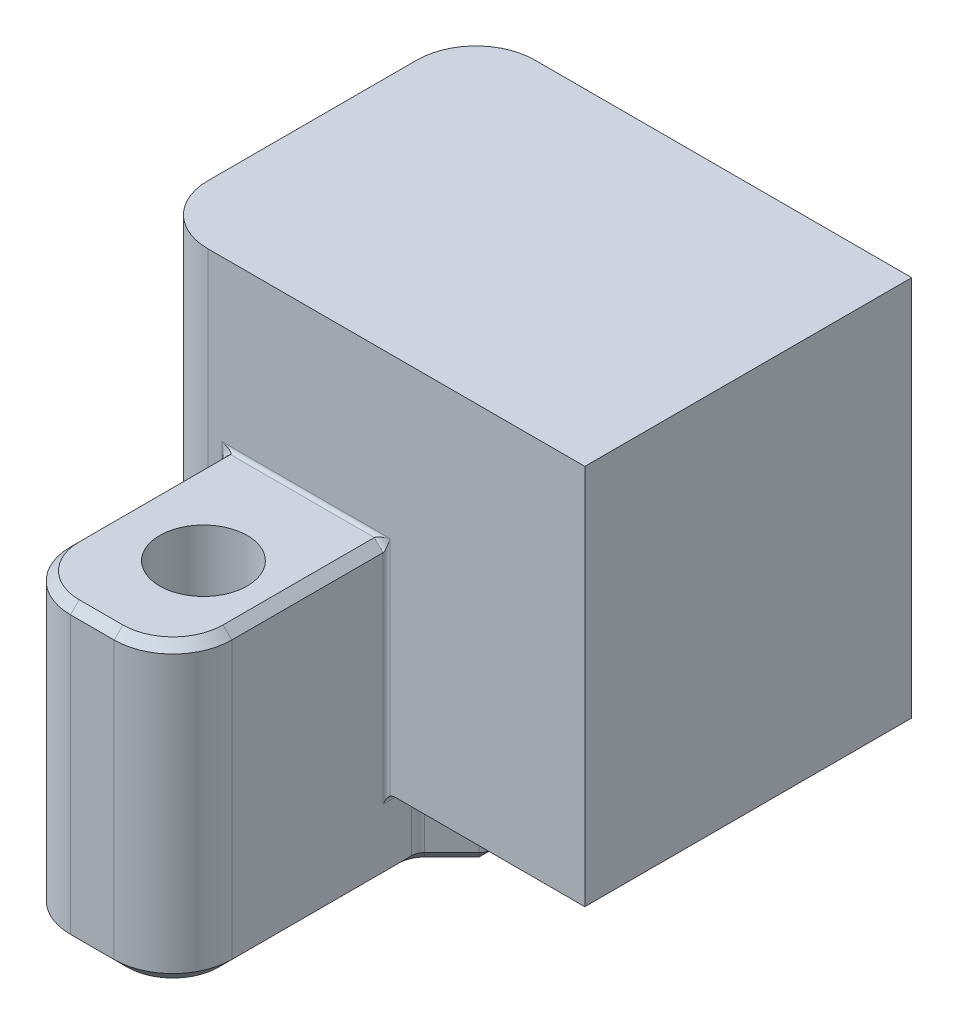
SolidWorks part; units mm, degrees
ref_plane "Front Plane" through (0, 0, 0) normal (0, 0, 1) x (1, 0, 0)
ref_plane "Top Plane" through (0, 0, 0) normal (0, 1, 0) x (1, 0, 0)
ref_plane "Right Plane" through (0, 0, 0) normal (1, 0, 0) x (0, 0, -1)
sketch "Sketch1" plane through (0, 0, 0) normal (0, 0, 1) x (1, 0, 0)
  line L0 (0, 0) -> (0, -22.225)
  line L5 (0, -22.225) -> (-9.525, -22.225)
  line L6 (-25.4, -26.924) -> (-25.4, 0)
  line L7 (-25.4, 0) -> (0, 0)
  line L10 (-25.4, -26.924) -> (-9.525, -26.924)
  line L13 (-9.525, -26.924) -> (-9.525, -22.225)
  dimension "D2" = 26.924
  dimension "D5" = 25.4
  dimension "D6" = 22.225
  dimension "D9" = 4.699
  dimension "D10" = 15.875
extrude "Boss-Extrude1" add sketch "Sketch1" along normal mid plane 19.05 contours L5 L13 L10 L6 L7 L0
fillet "Fillet5" radius 3.429 2 edges at (-25.4, -13.462, -9.525) (-25.4, -13.462, 9.525)
sketch "Sketch7" plane through (0, -26.924, 0) normal (0, -1, 0) x (1, 0, 0)
  line L0 (0, 9.525) -> (-9.525, 9.525) construction
  line L1 (-20.955, 9.525) -> (-11.557, 9.525)
  line L2 (-20.955, 9.525) -> (-20.955, 18.542)
  line L3 (-17.526, 21.971) -> (-14.986, 21.971)
  line L4 (-11.557, 9.525) -> (-11.557, 18.542)
  line L5 (0, 9.525) -> (0, -9.525) construction
  line L9 (-21.971, -9.525) -> (0, -9.525) construction
  line L10 (0, 9.525) -> (0, -9.525) construction
  line L11 (-21.971, 9.525) -> (0, 9.525) construction
  line L12 (-15.875, 15.875) -> (-17.9578, 15.875) construction
  line L13 (-17.5768, 13.589) -> (-15.5448, 13.589) construction
  line L15 (-17.5768, 18.161) -> (-15.5448, 18.161) construction
  line L17 (-22.225, 9.525) -> (-22.225, 40.8407) construction
  line L18 (-9.525, 9.525) -> (-9.525, 41.1038) construction
  arc A2 (-14.986, 21.971) -> (-11.557, 18.542) centre (-14.986, 18.542) cw
  arc A3 (-20.955, 18.542) -> (-17.526, 21.971) centre (-17.526, 18.542) cw
  circle A6 centre (-15.875, 15.875) radius 2.0828 construction
  arc A7 (-17.5768, 18.161) -> (-17.5768, 13.589) centre (-17.5768, 15.875) ccw construction
  arc A8 (-15.5448, 13.589) -> (-15.5448, 18.161) centre (-15.5448, 15.875) ccw construction
  dimension "D1" = 3.429
  dimension "D8" = 15.875
  dimension "D9" = 4.1656
  dimension "D10" = 9.398
  dimension "D6" = 6.604
  dimension "D11" = 1.0922
  dimension "D12" = 22.225
  dimension "D3" = 1.905
  dimension "D2" = 20.955
  dimension "D4" = 25.4
  dimension "D5" = 4.572
  dimension "D7" = 12.446
  dimension "D13" = 12.7
  dimension "D14" = 2.032
  dimension "D15" = 1.27
extrude "Boss-Extrude2" add sketch "Sketch7" against normal offset from surface (17.399 mm away) 9.525
fillet "Fillet6" radius 0.2032 3 edges at (-11.557, -18.2245, 9.525) (-20.955, -18.2245, 9.525) (-16.256, -9.525, 9.525)
sketch "Sketch13" plane through (0, -26.924, 0) normal (0, -1, 0) x (-1, 0, 0)
  line L4 (11.557, -7.747) -> (9.525, -5.715)
  line L9 (9.525, -9.525) -> (9.525, 9.525) construction
  line L16 (9.525, 5.715) -> (13.335, 9.525)
  line L19 (11.3538, -9.525) -> (9.525, -9.525) construction
  line L20 (11.3538, -9.525) -> (9.525, -9.525)
  line L21 (9.525, -9.525) -> (9.525, -5.715)
  line L22 (13.335, 9.525) -> (9.525, 9.525)
  line L23 (9.525, 9.525) -> (9.525, 5.715)
  line L26 (0, 9.525) -> (9.525, 9.525) construction
  line L27 (21.971, 9.525) -> (9.525, 9.525) construction
  line L28 (11.557, -9.7282) -> (11.557, -7.747)
  line L30 (11.557, -9.7282) -> (11.557, -18.542) construction
  arc A6 (11.557, -9.7282) -> (11.3538, -9.525) centre (11.3538, -9.7282) ccw
  arc A7 (11.557, -9.7282) -> (11.3538, -9.525) centre (11.3538, -9.7282) ccw construction
  dimension "D1" = 3.81
  dimension "D2" = 45
  dimension "D3" = 45
extrude "Cut-Extrude1" cut sketch "Sketch13" against normal up to surface (4.699 mm away)
fillet "Fillet8" radius 0.762 4 edges at (-13.335, -24.5745, -9.525) (-9.525, -24.5745, -5.715) (-9.525, -24.5745, 5.715) (-11.557, -24.5745, 7.747)
fillet "Fillet7" radius 0.508 8 edges at (-9.525, -22.225, 0) (-11.557, -22.225, 8.8954) (-11.499, -22.225, 7.771) (-10.541, -22.225, 6.731) (-9.583, -22.225, 5.691) (-13.359, -22.225, -9.467) (-11.43, -22.225, -7.62) (-9.583, -22.225, -5.691)
chamfer "Chamfer2" distance 0.508 angle 45 7 edges at (-20.955, -9.525, 14.1351) (-19.9507, -9.525, 20.9667) (-16.256, -9.525, 21.971) (-12.5613, -9.525, 20.9667) (-11.557, -9.525, 14.1351) (-21.0145, -9.4655, 9.5845) (-11.4975, -9.4655, 9.5845)
hole_wizard "1/4-20 Tapped Hole1" positions "Sketch9" profile "Sketch10" tap size "1/4-20" standard "ANSI Inch"
sketch "Sketch9" plane through (0, -9.525, 0) normal (0, 1, 0) x (1, 0, 0)
  line L4 (0, -9.525) -> (0, 9.525) construction
  point P0 (-15.875, -15.875)
  dimension "D1" = 15.875
  dimension "D2" = 15.875
sketch "Sketch10" plane through (-15.875, -9.525, 15.875) normal (1, 0, 0) x (0, 0, 1)
  line L0 (0, 0) -> (0, 17.399)
  line L1 (0, 17.399) -> (2.5527, 17.399)
  line L2 (2.5527, 17.399) -> (2.5527, 0)
  line L5 (2.5527, 0) -> (0, 0)
  line L11 (0, -6.35) -> (0, 107.95) construction
  dimension "Thru Tap Drill Dia." = 5.1054
  dimension "Thru Tap Drill Depth" = 17.399
chamfer "Chamfer3" distance 0.762 angle 45 13 edges at (-17.8108, -26.924, -9.525) (-11.43, -26.924, -7.62) (-9.525, -26.924, 0) (-10.541, -26.924, 6.731) (-11.557, -26.924, 13.3023) (-12.5613, -26.924, 20.9667) (-16.256, -26.924, 21.971) (-19.9507, -26.924, 20.9667) (-20.955, -26.924, 14.1351) (-21.5646, -26.924, 9.525) (-25.4, -26.924, 0) (-24.3957, -26.924, -8.5207) (-24.3957, -26.924, 8.5207)
